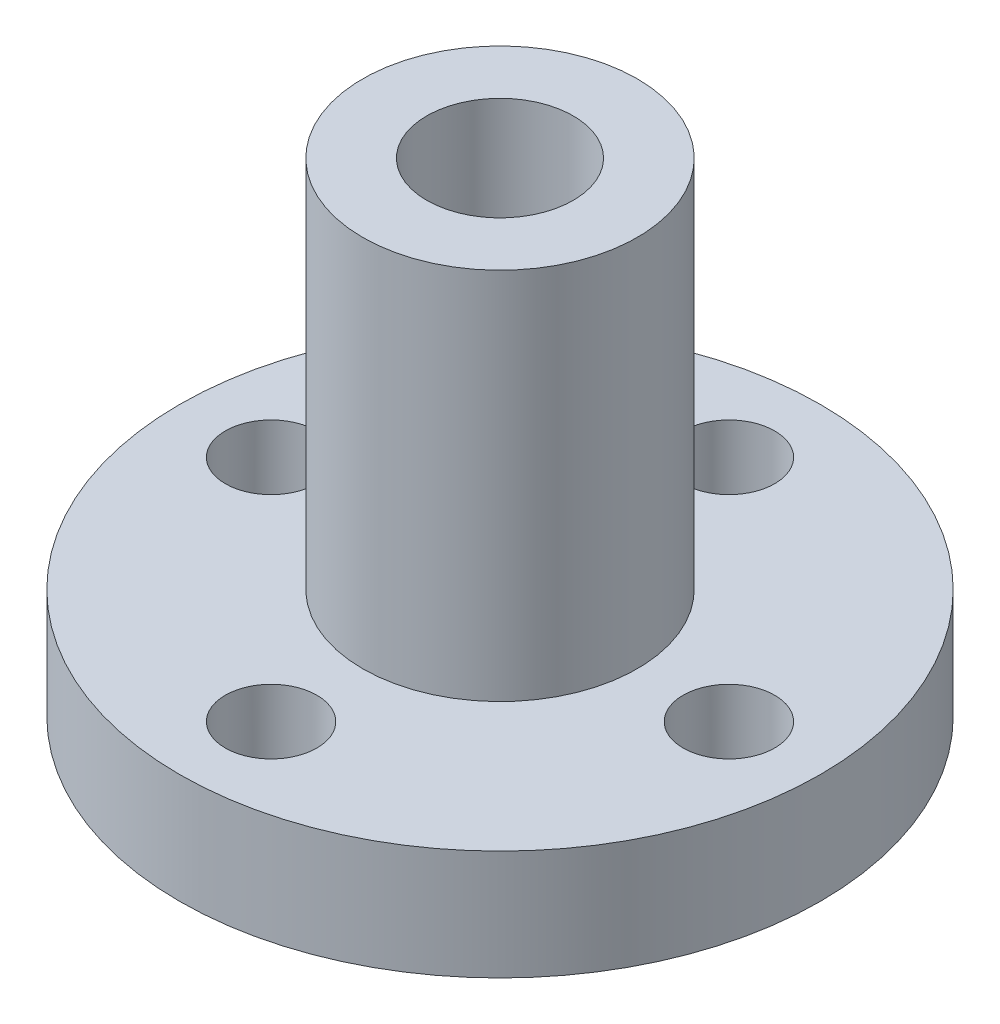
SolidWorks part; units mm, degrees
ref_plane "前视基准面" through (0, 0, 0) normal (0, 0, 1) x (1, 0, 0)
ref_plane "上视基准面" through (0, 0, 0) normal (0, 1, 0) x (1, 0, 0)
ref_plane "右视基准面" through (0, 0, 0) normal (1, 0, 0) x (0, 0, -1)
other "Configuration Table"
sketch "草图1" plane through (0, 0, 0) normal (0, 1, 0) x (1, 0, 0)
  circle A0 centre (0, 0) radius 17.5
  dimension "D1" = 35
extrude "凸台-拉伸1" add sketch "草图1" along normal blind 6
sketch "草图3" plane through (0, 6, 0) normal (0, 1, 0) x (1, 0, 0)
  circle A0 centre (0, 0) radius 7.5
  dimension "D1" = 15
extrude "凸台-拉伸2" add sketch "草图3" along normal blind 20.4
sketch "草图4" plane through (0, 26.4, 0) normal (0, 1, 0) x (1, 0, 0)
  circle A0 centre (0, 0) radius 4
  dimension "D1" = 8
extrude "切除-拉伸1" cut sketch "草图4" against normal through all
sketch "草图5" plane through (0, 6, 0) normal (0, 1, 0) x (1, 0, 0)
  circle A0 centre (0, 0) radius 12.5 construction
  circle A1 centre (0, 12.5) radius 2.5
  dimension "D1" = 25
  dimension "D2" = 5
extrude "切除-拉伸2" cut sketch "草图5" against normal blind 10
pattern_circular "阵列(圆周)1" count 4 every 90 about axis through (0, 0, 0) along (0, 1, 0) of "切除-拉伸2"
